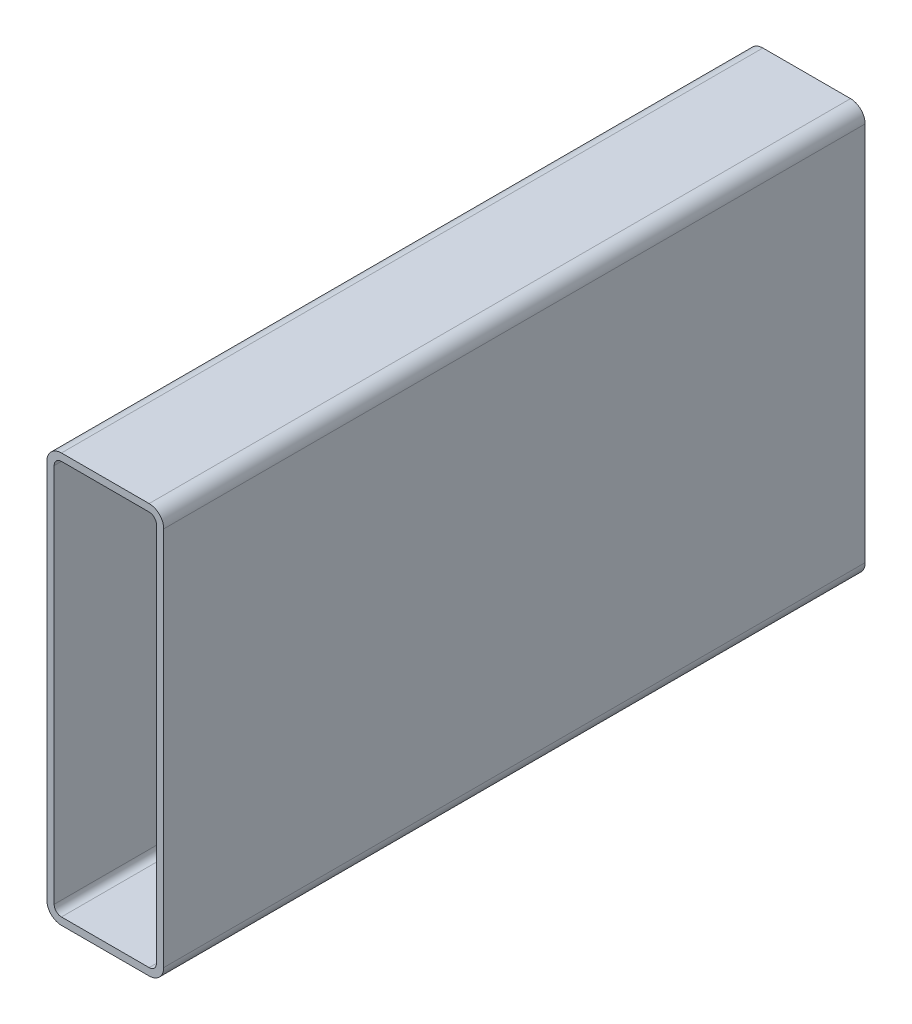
SolidWorks part; units mm, degrees
ref_plane "Front Plane" through (0, 0, 0) normal (0, 0, 1) x (1, 0, 0)
ref_plane "Top Plane" through (0, 0, 0) normal (0, 1, 0) x (1, 0, 0)
ref_plane "Right Plane" through (0, 0, 0) normal (1, 0, 0) x (0, 0, -1)
sketch "Sketch1" plane through (0, 0, 0) normal (0, 0, 1) x (1, 0, 0)
  line B0 (6.35, 177.8) -> (44.45, 177.8)
  arc B1 (50.8, 171.45) -> (44.45, 177.8) centre (44.45, 171.45) ccw
  line B2 (50.8, 171.45) -> (50.8, 6.35)
  arc B3 (44.45, 0) -> (50.8, 6.35) centre (44.45, 6.35) ccw
  line B4 (44.45, 0) -> (6.35, 0)
  arc B5 (0, 6.35) -> (6.35, 0) centre (6.35, 6.35) ccw
  line B6 (0, 6.35) -> (0, 171.45)
  arc B7 (6.35, 177.8) -> (0, 171.45) centre (6.35, 171.45) ccw
  line B8 (6.35, 174.625) -> (44.45, 174.625)
  arc B9 (47.625, 171.45) -> (44.45, 174.625) centre (44.45, 171.45) ccw
  line B10 (47.625, 171.45) -> (47.625, 6.35)
  arc B11 (44.45, 3.175) -> (47.625, 6.35) centre (44.45, 6.35) ccw
  line B12 (44.45, 3.175) -> (6.35, 3.175)
  arc B13 (3.175, 6.35) -> (6.35, 3.175) centre (6.35, 6.35) ccw
  line B14 (3.175, 6.35) -> (3.175, 171.45)
  arc B15 (6.35, 174.625) -> (3.175, 171.45) centre (6.35, 171.45) ccw
sketch_block_instance "HSS7x2x0.125-1"
sketch_block "HSS7x2x0.125"
extrude "Boss-Extrude1" add sketch "Sketch1" along normal blind 304.8
